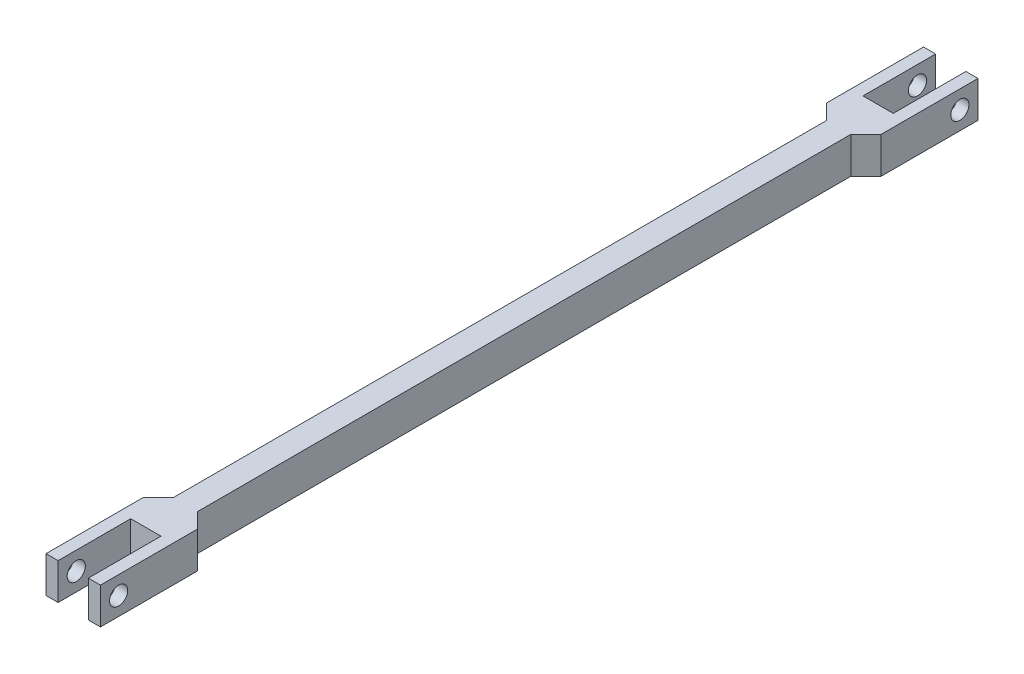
SolidWorks part; units mm, degrees
ref_plane "Plan de face" through (0, 0, 0) normal (0, 0, 1) x (1, 0, 0)
ref_plane "Plan de dessus" through (0, 0, 0) normal (0, 1, 0) x (1, 0, 0)
ref_plane "Plan de droite" through (0, 0, 0) normal (1, 0, 0) x (0, 0, -1)
sketch "Esquisse1" plane through (0, 0, 0) normal (0, 1, 0) x (1, 0, 0)
  line L2 (-2.5, 18.5) -> (-2.5, 126.5)
  line L3 (-2.5, 126.5) -> (0, 129)
  line L4 (0, 129) -> (0, 145)
  line L5 (0, 145) -> (-2, 145)
  line L6 (-2, 145) -> (-2, 133)
  line L7 (-2, 133) -> (-7, 133)
  line L8 (-7, 133) -> (-7, 145)
  line L9 (-7, 145) -> (-9, 145)
  line L10 (-9, 145) -> (-9, 129)
  line L11 (-9, 129) -> (-6.5, 126.5)
  line L12 (-6.5, 126.5) -> (-6.5, 18.5)
  line L13 (-6.5, 18.5) -> (-9, 16)
  line L14 (-9, 16) -> (-9, 0)
  line L15 (-9, 0) -> (-7, 0)
  line L16 (-7, 0) -> (-7, 12)
  line L17 (-7, 12) -> (-2, 12)
  line L18 (-2, 12) -> (-2, 0)
  line L19 (-2, 0) -> (0, 0)
  line L20 (0, 0) -> (0, 16)
  line L21 (0, 16) -> (-2.5, 18.5)
  dimension "D1" = 145
  dimension "D2" = 4
  dimension "D3" = 2
  dimension "D4" = 2
  dimension "D5" = 2
  dimension "D6" = 2
  dimension "D7" = 12
  dimension "D8" = 12
  dimension "D9" = 12
  dimension "D10" = 16
  dimension "D11" = 16
  dimension "D12" = 16
  dimension "D13" = 16
  dimension "D14" = 2.5
  dimension "D15" = 5
  dimension "D16" = 5
  dimension "D17" = 2.5
  dimension "D18" = 225
  dimension "D19" = 45
  dimension "D20" = 45
extrude "Boss.-Extru.1" add sketch "Esquisse1" along normal blind 6 contours L10 L11 L12 L13 L14 L15 L16 L17 L18 L19 L20 L21 L2 L3 L4 L5 L6 L7 L8 L9
sketch "Esquisse2" plane through (-9, 0, 0) normal (-1, 0, 0) x (0, 0, 1)
  line L0 (-145, 6) -> (-129, 6) construction
  line L2 (-145, 6) -> (-145, 0) construction
  line L3 (0, 6) -> (0, 0) construction
  line L4 (-16, 6) -> (0, 6) construction
  circle A0 centre (-142, 3) radius 1.5
  circle A1 centre (-3, 3) radius 1.5
  dimension "D1" = 3
  dimension "D4" = 3
  dimension "D2" = 3
  dimension "D3" = 3
  dimension "D5" = 3
  dimension "D6" = 3
extrude "Enlèv. mat.-Extru.1" cut sketch "Esquisse2" against normal through all
